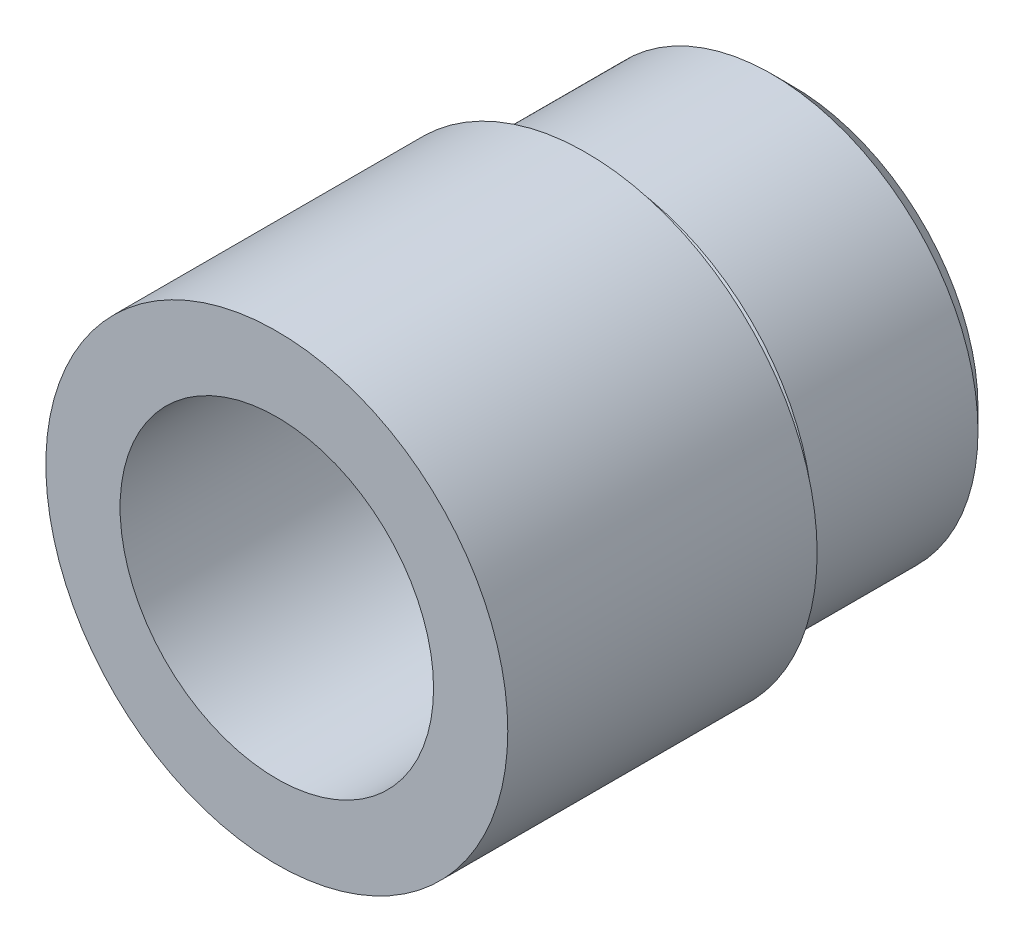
SolidWorks part; units mm, degrees
ref_plane "Front" through (0, 0, 0) normal (0, 0, 1) x (1, 0, 0)
ref_plane "Top" through (0, 0, 0) normal (0, 1, 0) x (1, 0, 0)
ref_plane "Right" through (0, 0, 0) normal (1, 0, 0) x (0, 0, -1)
sketch "Sketch1" plane through (0, 0, 0) normal (1, 0, 0) x (0, 0, -1)
  line L0 (0, 0) -> (56.7407, 0) construction
  line L1 (16.395, 9.652) -> (16.395, 14.224)
  line L2 (16.395, 14.224) -> (35.445, 14.224)
  line L3 (35.445, 14.224) -> (35.445, 11.43)
  line L4 (35.445, 11.43) -> (36.715, 12.7)
  line L5 (36.715, 12.7) -> (46.875, 12.7)
  line L6 (46.875, 12.7) -> (48.145, 11.43)
  line L7 (48.145, 11.43) -> (48.145, 9.652)
  line L8 (16.395, 9.652) -> (48.145, 9.652)
  dimension "NUTID" = 19.304
  dimension "NUTOD" = 28.448
  dimension "NUTLength" = 31.75
  dimension "NUTThreadLength" = 12.7
  dimension "NUTThreadInside" = 1.27
  dimension "NUTThreadOutside" = 1.27
  dimension "NUTThreadOD" = 25.4
  dimension "NUTThreadUnderCut" = 1.27
revolve "Revolve1" add sketch "Sketch1" angle 360 about L0
equation "\"NUTThreadUnderCut@Sketch1\" = .1*\"NUTThreadLength@Sketch1\""
equation "\"NUTThreadOutside@Sketch1\"=.1*\"NUTThreadLength@Sketch1\""
equation "\"NUTThreadInside@Sketch1\"=.1*\"NUTThreadLength@Sketch1\""
